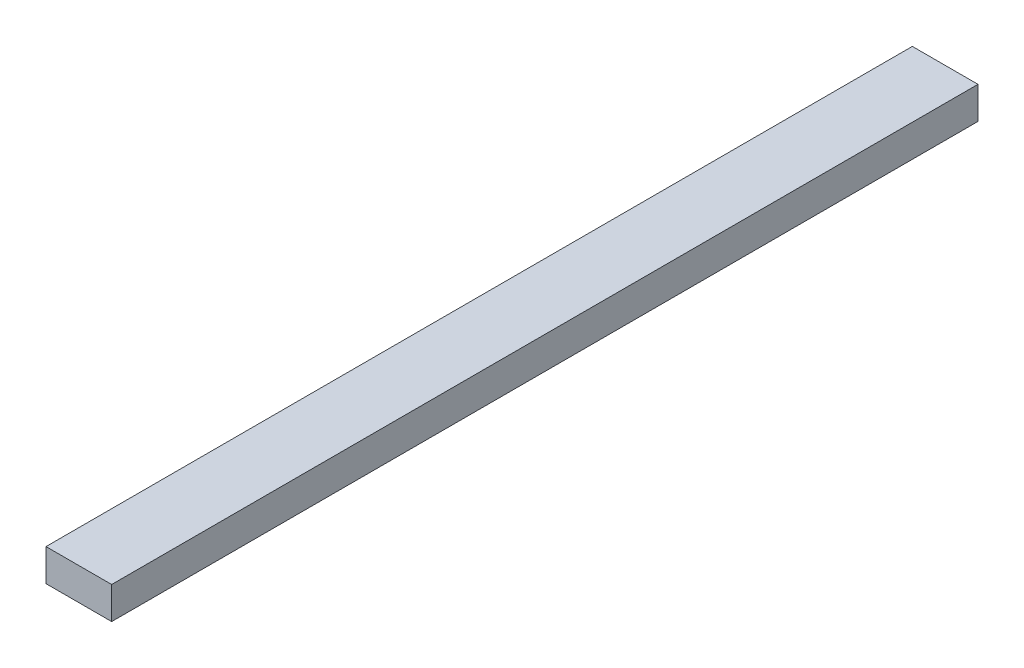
SolidWorks part; units mm, degrees
ref_plane "Plan de face" through (0, 0, 0) normal (0, 0, 1) x (1, 0, 0)
ref_plane "Plan de dessus" through (0, 0, 0) normal (0, 1, 0) x (1, 0, 0)
ref_plane "Plan de droite" through (0, 0, 0) normal (1, 0, 0) x (0, 0, -1)
sketch "Esquisse1" plane through (0, 0, 0) normal (0, 0, 1) x (1, 0, 0)
  line L1 (-23.5, 11.5) -> (23.5, 11.5)
  line L2 (-23.5, 11.5) -> (-23.5, -11.5)
  line L3 (-23.5, -11.5) -> (23.5, -11.5)
  line L4 (23.5, 11.5) -> (23.5, -11.5)
  line L5 (-23.5, 11.5) -> (23.5, -11.5) construction
  line L6 (-23.5, -11.5) -> (23.5, 11.5) construction
  point P0 (0, 0)
  dimension "D1" = 47
  dimension "D2" = 23
extrude "Boss.-Extru.1" add sketch "Esquisse1" along normal blind 620
